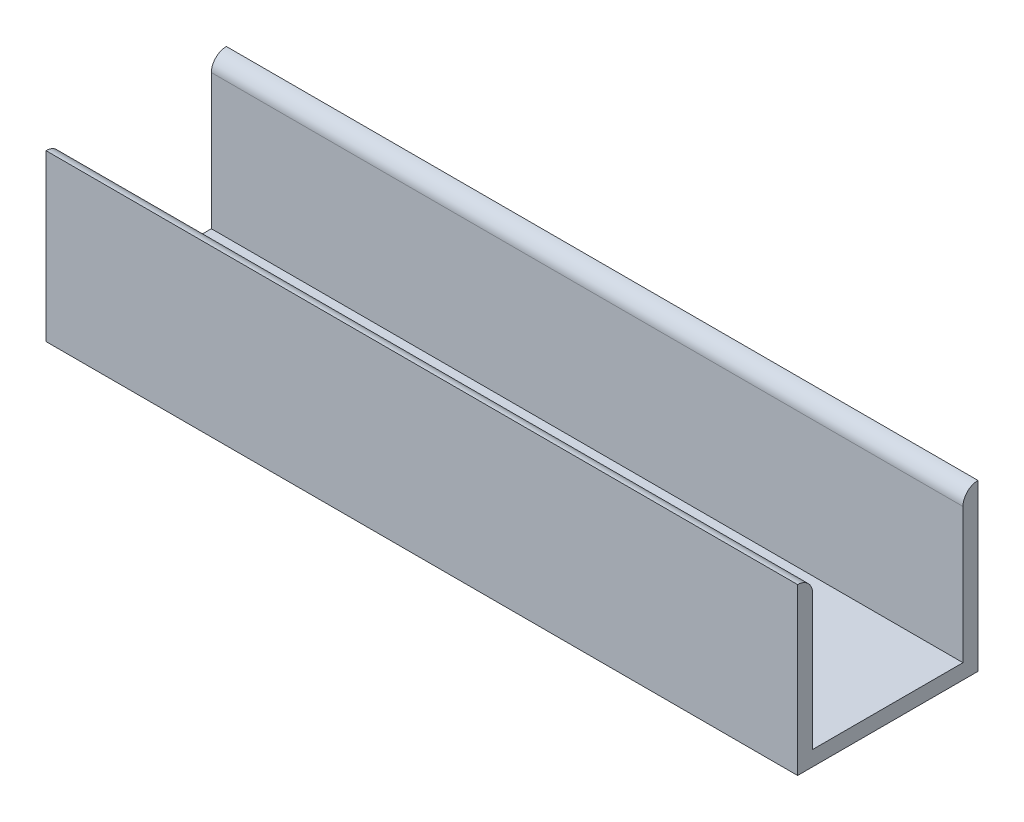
SolidWorks part; units mm, degrees
ref_plane "Vorne" through (0, 0, 0) normal (0, 0, 1) x (1, 0, 0)
ref_plane "Oben" through (0, 0, 0) normal (0, 1, 0) x (1, 0, 0)
ref_plane "Rechts" through (0, 0, 0) normal (1, 0, 0) x (0, 0, -1)
sketch "Skizze1" plane through (0, 0, 0) normal (1, 0, 0) x (0, 0, -1)
  line L0 (-100, 200) -> (-100, 0)
  line L1 (-100, 0) -> (100, 0)
  line L2 (100, 0) -> (100, 200)
  dimension "D1" = 200
  dimension "D2" = 200
extrude "Linear-Austragen-Dünn1" add sketch "Skizze1" against normal blind 1000 thin
fillet "Verrundung1" radius 20 2 edges at (-500, 200, 100) (-500, 200, -100)
